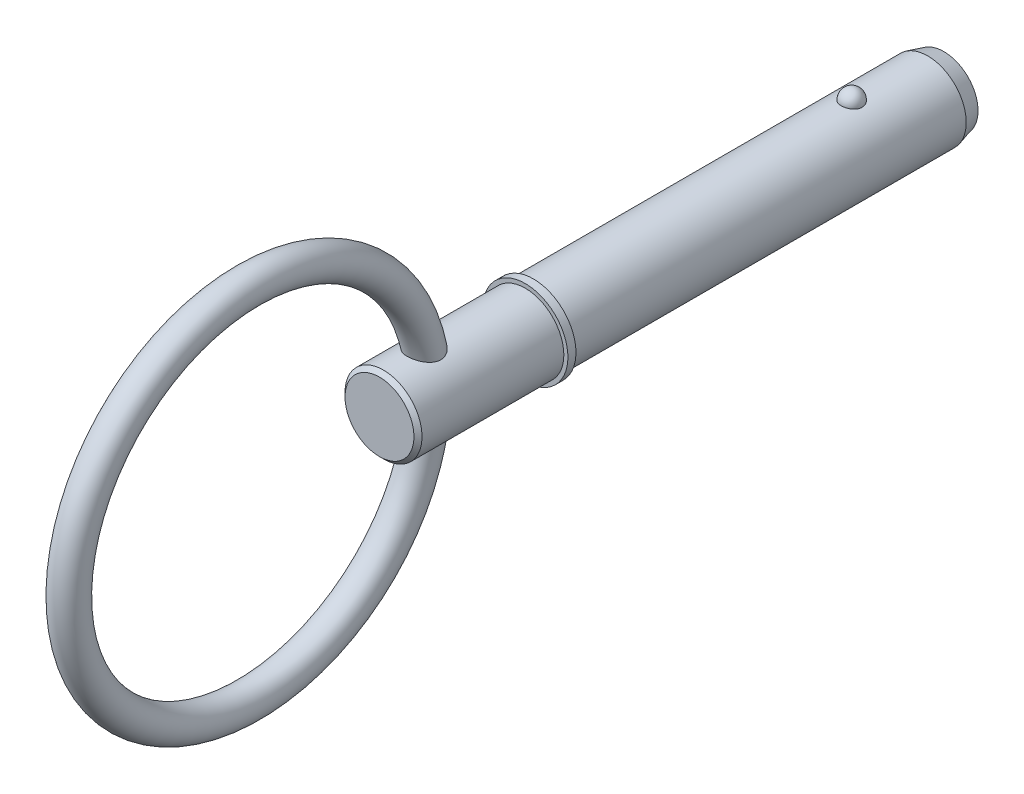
SolidWorks part; units mm, degrees
ref_plane "Front Plane" through (0, 0, 0) normal (0, 0, 1) x (1, 0, 0)
ref_plane "Top Plane" through (0, 0, 0) normal (0, 1, 0) x (1, 0, 0)
ref_plane "Right Plane" through (0, 0, 0) normal (1, 0, 0) x (0, 0, -1)
sketch "Sketch2" plane through (0, 0, 0) normal (0, 0, 1) x (1, 0, 0)
  circle A0 centre (0, 0) radius 4.765
  point P3 (0, 4.765)
  dimension "D1" = 9.53
extrude "Boss-Extrude1" add sketch "Sketch2" along normal blind 38.1
sketch "Sketch3" plane through (0, 0, 0) normal (0, 0, -1) x (-1, 0, 0)
  circle A0 centre (0, 0) radius 4.765
  dimension "D1" = 9.53
extrude "Boss-Extrude2" add sketch "Sketch3" along normal blind 12.7
chamfer "Chamfer1" distance 2 angle 15 1 edges at (-4.765, 0, -12.7)
sketch "Sketch18" plane through (0, 0, 0) normal (1, 0, 0) x (0, 0, -1)
  line L0 (10.7, 4.765) -> (-38.1, 4.765) construction
  line L1 (1.29, 6.055) -> (1.29, 3.475)
  line L2 (-38.1, -4.765) -> (10.7, -4.765) construction
  arc A0 (1.29, 6.055) -> (1.29, 3.475) centre (1.29, 4.765) ccw
  point P4 (0, 4.765)
  dimension "D1" = 10.82
revolve "Revolve1" add sketch "Sketch18" angle 360 about L1
sketch "Sketch19" plane through (0, 0, 0) normal (1, 0, 0) x (0, 0, -1)
  line L0 (-33.7288, 0) -> (-46.4542, 0) construction
sketch "Sketch20" plane through (0, 0, 0) normal (1, 0, 0) x (0, 0, -1)
  line L0 (-38.1, 0) -> (-38.1, 5.265)
  line L1 (-38.1, 4.765) -> (-38.1, -4.765) construction
  line L2 (-38.1, 5.265) -> (-39.1, 5.265)
  line L3 (-39.1, 5.265) -> (-39.1, 0)
  line L4 (-33.7288, 0) -> (-46.4542, 0) construction
  line L5 (-39.1, 0) -> (-38.1, 0)
  dimension "D1" = 5.265
  dimension "D2" = 1
revolve "Revolve2" add sketch "Sketch20" angle 360 about L0
sketch "Sketch21" plane through (0, 0, 38.1) normal (0, 0, -1) x (-1, 0, 0)
  circle A0 centre (0, 0) radius 4.765
  dimension "D1" = 9.53
extrude "Boss-Extrude3" add sketch "Sketch21" against normal blind 19.05
chamfer "Chamfer2" distance 0.5 angle 45 1 edges at (-4.765, 0, 57.15)
sketch "Sketch23" plane through (0, 0, 0) normal (1, 0, 0) x (0, 0, -1)
  line L0 (-57.15, 4.265) -> (-57.15, -4.265) construction
  circle A0 centre (-73.375, 0) radius 22.225
  point P2 (-51.15, 0)
  dimension "D1" = 44.45
  dimension "D2" = 6
sketch "Sketch24" plane through (0, 0, 0) normal (0, 1, 0) x (1, 0, 0)
  circle A0 centre (0, -51.15) radius 2
  dimension "D1" = 4
sweep "Sweep1" add profiles "Sketch24" path "Sketch23"
